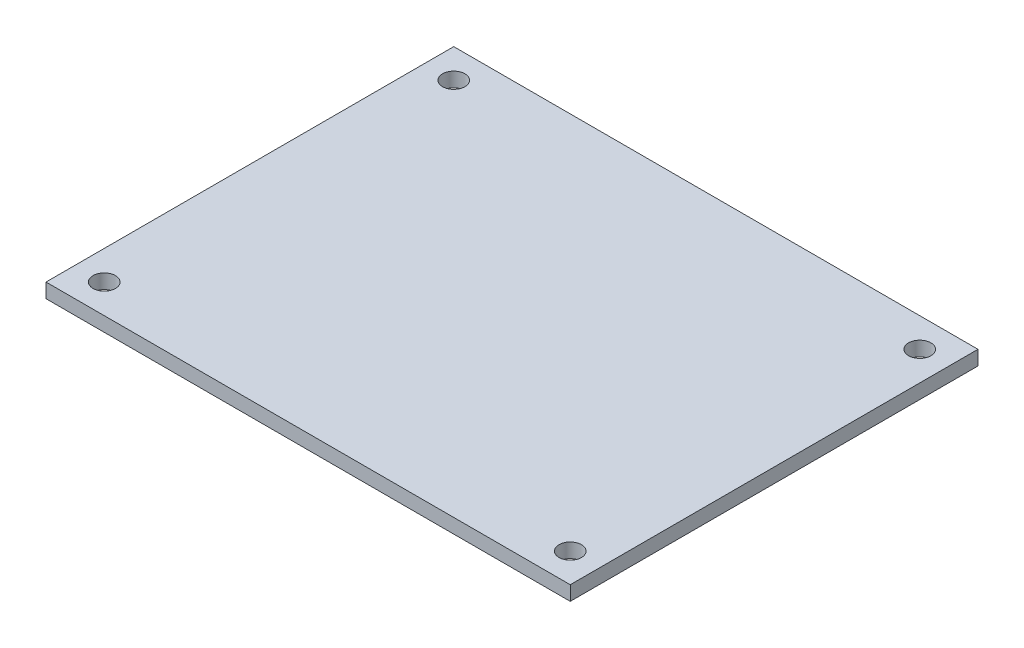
SolidWorks part; units mm, degrees
ref_plane "Front Plane" through (0, 0, 0) normal (0, 0, 1) x (1, 0, 0)
ref_plane "Top Plane" through (0, 0, 0) normal (0, 1, 0) x (1, 0, 0)
ref_plane "Right Plane" through (0, 0, 0) normal (1, 0, 0) x (0, 0, -1)
sketch "Sketch1" plane through (0, 0, 0) normal (0, 1, 0) x (1, 0, 0)
  line L1 (0, 0) -> (57.15, 0)
  line L2 (0, 0) -> (0, 44.45)
  line L3 (0, 44.45) -> (57.15, 44.45)
  line L4 (57.15, 0) -> (57.15, 44.45)
  circle A0 centre (53.975, 3.175) radius 1.2192
  circle A1 centre (3.175, 3.175) radius 1.2192
  circle A2 centre (3.175, 41.275) radius 1.2192
  circle A3 centre (53.975, 41.275) radius 1.2192
  point P13 (0, 0)
  point P14 (0, 0)
  point P15 (53.9735, 38.1)
  point P16 (0, 0)
  point P17 (0, 0)
  dimension "D3" = 2.4384
  dimension "D4" = 3.175
  dimension "D1" = 44.45
  dimension "D2" = 57.15
  dimension "D5" = 3.175
  dimension "D6" = 3.175
  dimension "D7" = 3.175
extrude "Boss-Extrude1" add sketch "Sketch1" along normal blind 1.5748
